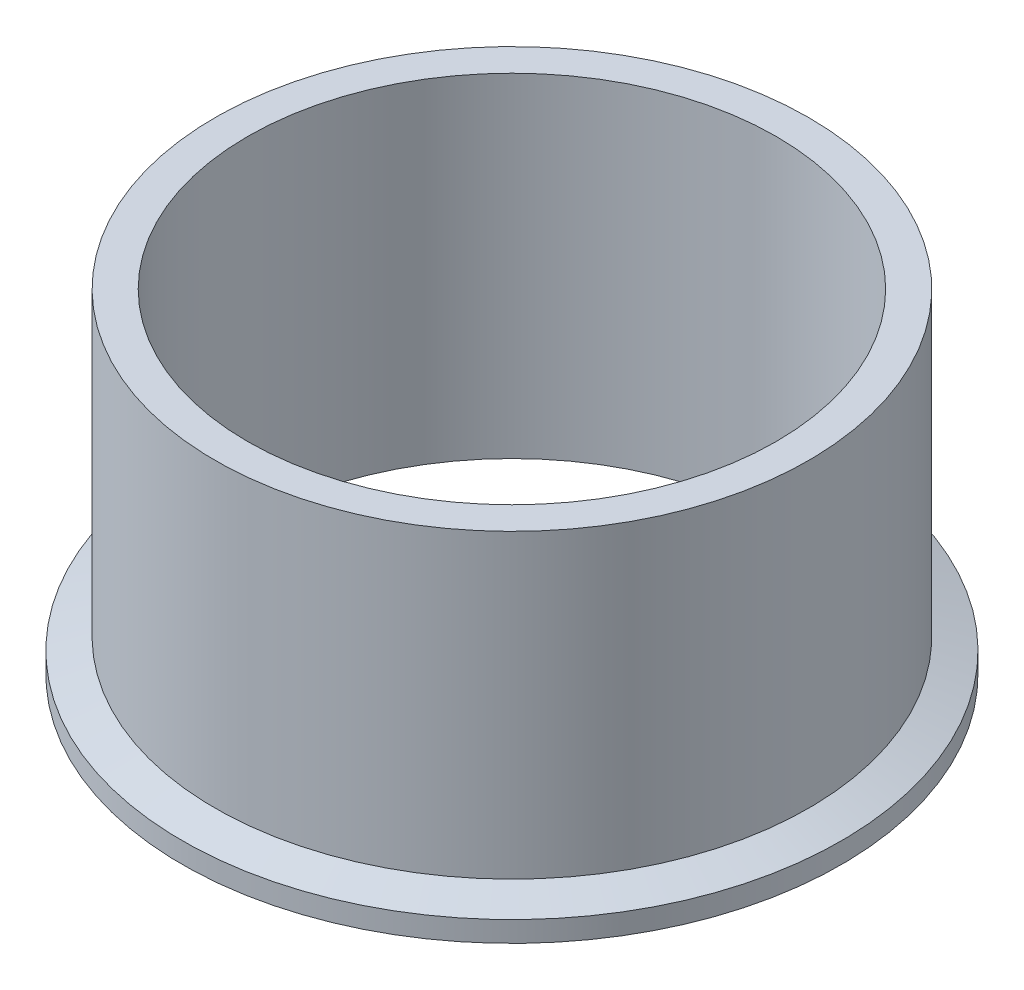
SolidWorks part; units mm, degrees
ref_plane "Front Plane" through (0, 0, 0) normal (0, 0, 1) x (1, 0, 0)
ref_plane "Top Plane" through (0, 0, 0) normal (0, 1, 0) x (1, 0, 0)
ref_plane "Right Plane" through (0, 0, 0) normal (1, 0, 0) x (0, 0, -1)
sketch "Sketch1" plane through (0, 0, 0) normal (0, 0, 1) x (1, 0, 0)
  line L0 (0, 0) -> (0, 46.0248) construction
  line L1 (0, 46.0248) -> (-40.9448, 46.0248)
  line L2 (-40.9448, 46.0248) -> (-40.9448, 4.4858)
  line L3 (-40.9448, 4.4858) -> (-45.4533, 2.8448)
  line L4 (-45.4533, 2.8448) -> (-45.4533, 0)
  line L5 (-45.4533, 0) -> (-43.4867, 0)
  line L6 (-39.8507, 0) -> (0, 0)
  line L7 (0, 0) -> (0, 46.0248)
  line L8 (0, 46.0248) -> (-36.449, 46.0248)
  line L9 (-36.449, 46.0248) -> (-36.449, 0)
  line L10 (-36.449, 0) -> (0, 0)
  line L11 (0, 0) -> (-0.1846, 0.0129)
  arc A0 (-42.7642, 0.4745) -> (-40.5732, 0.4745) centre (-41.6687, 0) cw
  arc A1 (-39.8507, 0) -> (-40.5732, 0.4745) centre (-39.8507, 0.7874) cw
  arc A2 (-42.7642, 0.4745) -> (-43.4867, 0) centre (-43.4867, 0.7874) cw
  point P12 (-40.4749, 0)
  dimension "D6" = 1.1938
  dimension "D7" = 0.7874
  dimension "D1" = 40.9448
  dimension "D2" = 2.8448
  dimension "D3" = 45.4533
  dimension "D4" = 70
  dimension "D5" = 41.6687
  dimension "D8" = 36.449
  dimension "D9" = 46.0248
revolve "Revolve2" add sketch "Sketch1" angle 360 about L0
